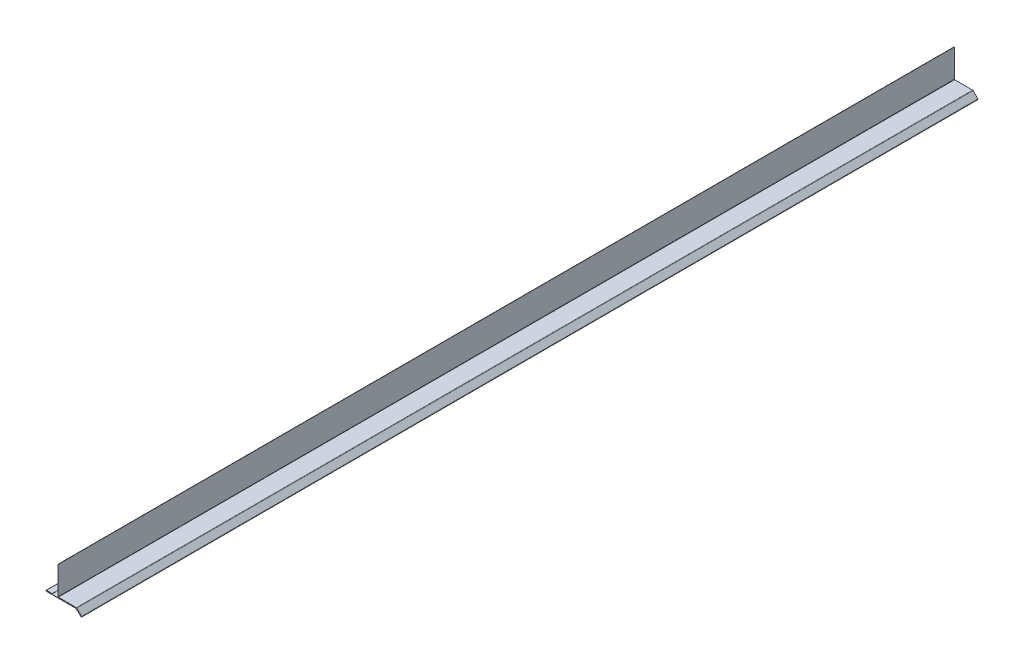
SolidWorks part; units mm, degrees
ref_plane "Front" through (0, 0, 0) normal (0, 0, 1) x (1, 0, 0)
ref_plane "Top" through (0, 0, 0) normal (0, 1, 0) x (1, 0, 0)
ref_plane "Right" through (0, 0, 0) normal (1, 0, 0) x (0, 0, -1)
sketch "Sketch1" plane through (0, 0, 0) normal (0, 0, 1) x (1, 0, 0)
  line L0 (0, 1) -> (0, 63.5)
  line L1 (1, 0) -> (41.275, 0)
  line L2 (41.9934, -0.2976) -> (52.6491, -10.9533)
  line L3 (41.0646, -1.016) -> (-25.4, -1.016)
  line L4 (51.9307, -11.6717) -> (41.4238, -1.1648)
  line L5 (-12.7, 0) -> (-25.4, 0)
  arc A0 (52.6491, -10.9533) -> (51.9307, -11.6717) centre (52.2899, -11.3125) cw
  arc A1 (41.0646, -1.016) -> (41.4238, -1.1648) centre (41.0646, -1.524) cw
  arc A2 (41.9934, -0.2976) -> (41.275, 0) centre (41.275, -1.016) ccw
  arc A3 (0, 1) -> (1, 0) centre (1, 1) ccw
  arc A4 (-25.4, -1.016) -> (-25.4, 0) centre (-25.4, -0.508) cw
  point P18 (0, 0)
  dimension "D5" = 1.016
  dimension "D3" = 1.016
  dimension "D2" = 0.508
  dimension "D10" = 12.7
  dimension "D1" = 63.5
  dimension "D4" = 225
  dimension "D6" = 1.016
  dimension "D7" = 41.275
  dimension "D8" = 14.859
  dimension "D9" = 25.4
extrude "Extrude-Thin1" add sketch "Sketch1" along normal blind 2000 thin
